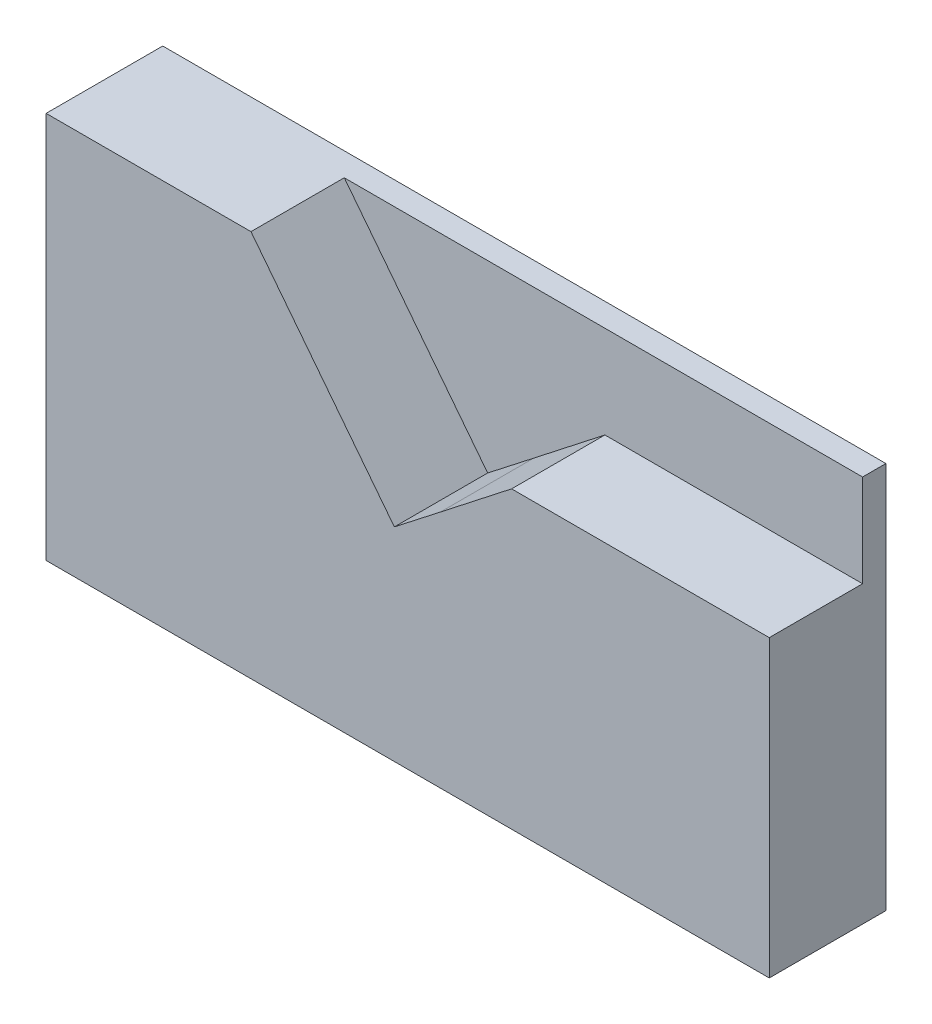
SolidWorks part; units mm, degrees
ref_plane "Front Plane" through (0, 0, 0) normal (0, 0, 1) x (1, 0, 0)
ref_plane "Top Plane" through (0, 0, 0) normal (0, 1, 0) x (1, 0, 0)
ref_plane "Right Plane" through (0, 0, 0) normal (1, 0, 0) x (0, 0, -1)
sketch "Sketch1" plane through (0, 0, 0) normal (0, 0, 1) x (1, 0, 0)
  line L1 (0, 0) -> (-39.37, 0)
  line L2 (0, 0) -> (0, 21.082)
  line L3 (0, 21.082) -> (-39.37, 21.082)
  line L4 (-39.37, 0) -> (-39.37, 21.082)
  dimension "D1" = 39.37
  dimension "D2" = 21.082
extrude "Extrude1" add sketch "Sketch1" along normal blind 6.35
sketch "Sketch2" plane through (0, 0, 6.35) normal (0, 0, 1) x (1, 0, 0)
  line L0 (28.2167, 21.082) -> (20.4104, 11.0644)
  line L1 (20.4104, 11.0644) -> (17.906, 13.016)
  line L2 (17.906, 13.016) -> (14.0278, 16.0486)
  line L3 (-14.0278, 16.0486) -> (14.0278, 16.0486)
  line L4 (28.2167, 21.082) -> (17.1596, 29.6983) construction
  line L5 (28.2167, 21.082) -> (-28.2167, 21.082)
  line L6 (0, 16.0486) -> (0, 21.082)
  line L8 (0, 0) -> (0, 21.082) construction
  line L9 (-28.2167, 21.082) -> (-17.1596, 29.6983) construction
  line L10 (-20.4104, 11.0644) -> (-17.906, 13.016)
  line L11 (-28.2167, 21.082) -> (-20.4104, 11.0644)
  line L12 (-17.906, 13.016) -> (-14.0278, 16.0486)
  dimension "D1" = 3.175
  dimension "D2" = 12.7
  dimension "D3" = 14.0278
  dimension "D4" = 28.2167
  dimension "D5" = 5.0334
  dimension "D6" = 4.9232
extrude "Cut-Extrude1" cut sketch "Sketch2" against normal blind 5.08 contours L10 L12 L3 L11 M1 M2
